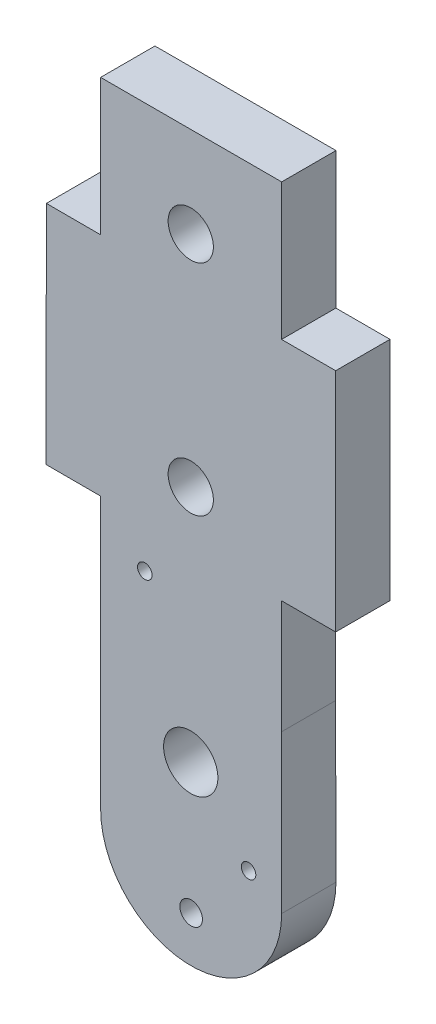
SolidWorks part; units mm, degrees
ref_plane "Front Plane" through (0, 0, 0) normal (0, 0, 1) x (1, 0, 0)
ref_plane "Top Plane" through (0, 0, 0) normal (0, 1, 0) x (1, 0, 0)
ref_plane "Right Plane" through (0, 0, 0) normal (1, 0, 0) x (0, 0, -1)
sketch "Sketch1" plane through (0, 0, 0) normal (0, 0, 1) x (1, 0, 0)
  line L0 (237.2983, -254.6167) -> (217.2983, -254.6167) construction
  line L1 (237.2983, -254.6167) -> (237.3422, -271.9713)
  line L2 (217.3422, -254.6167) -> (217.3422, -271.9713)
  line L3 (217.3422, -211.9713) -> (217.3422, -201.9713)
  line L4 (217.3422, -201.9713) -> (237.3422, -201.9713)
  line L5 (237.3422, -201.9713) -> (237.3296, -217.0499)
  line L6 (237.3088, -242.0499) -> (243.3088, -242.0499)
  line L7 (243.3088, -242.0499) -> (243.3088, -217.0499)
  line L8 (243.3088, -217.0499) -> (237.3296, -217.0499)
  line L9 (227.3422, -201.9713) -> (227.2983, -254.6167) construction
  line L10 (211.3504, -217.0232) -> (217.3296, -217.0332)
  line L11 (211.3088, -242.0232) -> (211.3504, -217.0232)
  line L12 (217.3088, -242.0332) -> (211.3088, -242.0232)
  line L13 (237.3088, -242.0499) -> (237.2983, -254.6167)
  line L14 (217.3422, -254.6167) -> (217.3422, -242.0332)
  line L15 (217.3088, -242.0332) -> (217.3422, -242.0332)
  line L16 (217.3296, -217.0332) -> (217.3422, -217.0332)
  line L17 (217.3422, -217.0332) -> (217.3422, -211.9713)
  circle A0 centre (233.6844, -269.7029) radius 1
  circle A1 centre (222.2244, -246.7638) radius 1
  circle A2 centre (227.2983, -262.5079) radius 4
  arc A3 (217.3422, -271.9713) -> (237.342, -271.9208) centre (227.3422, -271.9713) ccw
  circle A4 centre (227.3422, -276.9055) radius 1.25
  circle A5 centre (227.2983, -211.9713) radius 2.5
  circle A6 centre (227.2983, -236.1763) radius 2.5
extrude "Boss-Extrude1" add sketch "Sketch1" along normal blind 6 contours L2 A3 L1 L13 L6 L7 L8 L5 L4 L3 L17 L16 L10 L11 L12 L15 L14 A6 A5 A4 A0 A1 A2
sketch "Sketch2" plane through (0, 0, 6) normal (0, 0, 1) x (1, 0, 0)
  circle A1 centre (222.2244, -246.7638) radius 0.8
  circle A2 centre (222.2244, -246.7638) radius 1
  circle A3 centre (233.6844, -269.7029) radius 0.8
  circle A4 centre (233.6844, -269.7029) radius 1
extrude "Boss-Extrude2" add sketch "Sketch2" against normal blind 6
sketch "Sketch3" plane through (0, 0, 6) normal (0, 0, 1) x (1, 0, 0)
  circle A0 centre (227.2983, -262.5079) radius 4
  circle A1 centre (227.2983, -262.5079) radius 3
extrude "Boss-Extrude3" add sketch "Sketch3" against normal blind 6
